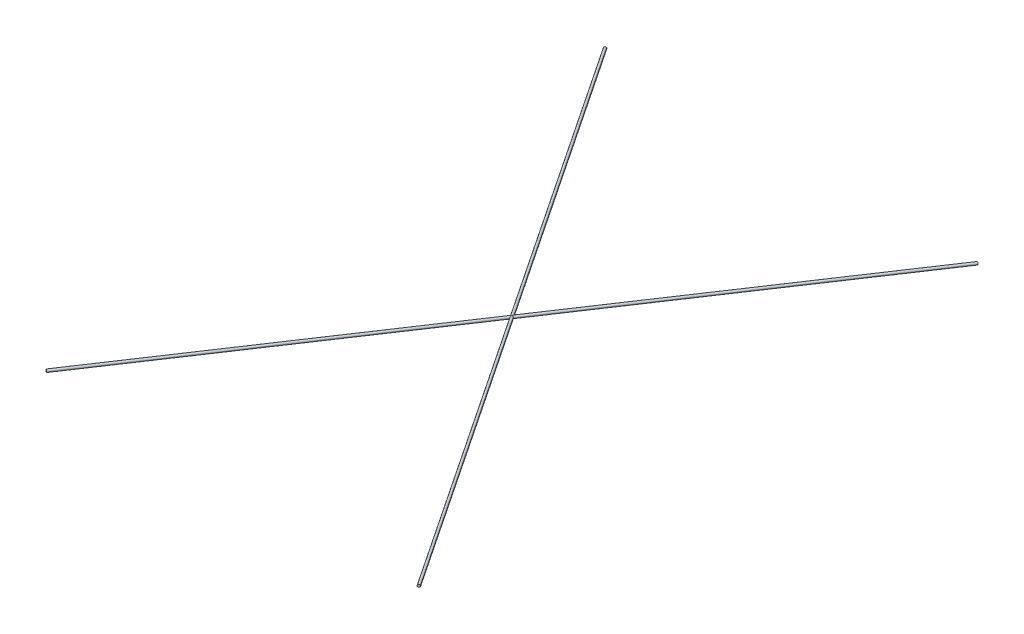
SolidWorks part; units mm, degrees
ref_plane "Front Plane" through (0, 0, 0) normal (0, 0, 1) x (1, 0, 0)
ref_plane "Top Plane" through (0, 0, 0) normal (0, 1, 0) x (1, 0, 0)
ref_plane "Right Plane" through (0, 0, 0) normal (1, 0, 0) x (0, 0, -1)
sketch "Sketch1" plane through (0, 0, 0) normal (0, 1, 0) x (1, 0, 0)
  line L1 (-722.6483, -1083.9752) -> (722.6483, 1083.9752)
  line L2 (0, 0) -> (0, 38.4593) construction
  line L3 (0, 0) -> (32.4616, 0) construction
  point P4 (0, 0)
  point P7 (0, 0)
  dimension "D2" = 2605.55
  dimension "D4" = 33.69
sketch "Sketch2" plane through (0, 0, 0) normal (0, 1, 0) x (1, 0, 0)
  line L0 (0, 0) -> (19.2894, 0) construction
  line L2 (0, 0) -> (0, 6.8275) construction
  line L4 (722.6483, -1083.9752) -> (-722.6483, 1083.9752)
  point P7 (0, 0)
  dimension "D1" = 33.69
  dimension "D2" = 2605.55
ref_plane "Plane1" through (722.6483, 0, 1083.9752) normal (-0.5547, 0, -0.8321) x (-0.8321, 0, 0.5547)
ref_plane "Plane2" through (722.6483, 0, -1083.9752) normal (0.5547, 0, -0.8321) x (-0.8321, 0, -0.5547)
sketch "Sketch3" plane through (722.6483, 0, 1083.9752) normal (-0.5547, 0, -0.8321) x (-0.8321, 0, 0.5547)
  circle A0 centre (0, 0) radius 5
  dimension "D1" = 10
sketch "Sketch4" plane through (722.6483, 0, -1083.9752) normal (0.5547, 0, -0.8321) x (-0.8321, 0, -0.5547)
  circle A0 centre (0, 0) radius 5
  dimension "D1" = 10
sweep "Sweep1" add profiles "Sketch3" path "Sketch2"
sweep "Sweep2" add profiles "Sketch4" path "Sketch1"
